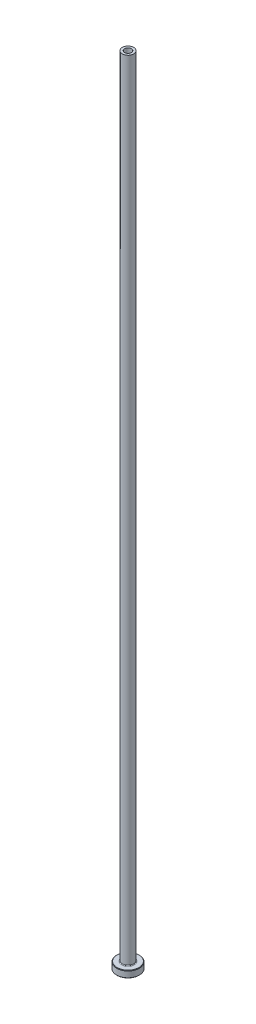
SolidWorks part; units mm, degrees
ref_plane "Front Plane" through (0, 0, 0) normal (0, 0, 1) x (1, 0, 0)
ref_plane "Top Plane" through (0, 0, 0) normal (0, 1, 0) x (1, 0, 0)
ref_plane "Right Plane" through (0, 0, 0) normal (1, 0, 0) x (0, 0, -1)
sketch "Sketch1" plane through (0, 0, 0) normal (0, 0, 1) x (1, 0, 0)
  line L0 (-1.5, 350) -> (-2.5, 350)
  line L1 (-2.5, 350) -> (-2.5, 3)
  line L2 (-2.5, 3) -> (-5, 3)
  line L3 (-5, 3) -> (-5, 0)
  line L4 (5.5, 0) -> (-5.5, 0) construction
  line L5 (-5, 0) -> (-1.75, 0)
  line L6 (-1.5, 305) -> (-1.5, 350)
  line L7 (0, 92.1877) -> (0, -15.5353) construction
  line L8 (0, -5.5) -> (0, 5.5) construction
  line L9 (-1.5, 305) -> (-1.75, 293)
  line L10 (-1.75, 293) -> (-1.75, 0)
  dimension "D1" = 0.25
  dimension "ID" = 3
  dimension "OD" = 5
  dimension "L" = 350
  dimension "H" = 10
  dimension "T" = 3
  dimension "N" = 45
  dimension "D2" = 12
revolve "Revolve1" add sketch "Sketch1" angle 360 about L7
fillet "Fillet1" radius 0.3 1 edges at (0, 3, 2.5)
chamfer "Chamfer1" distance 0.2 angle 45 2 edges at (0, 3, 5) (0, 0, 5)
chamfer "Chamfer3" distance 0.5 angle 45 1 edges at (0, 0, 1.75)
